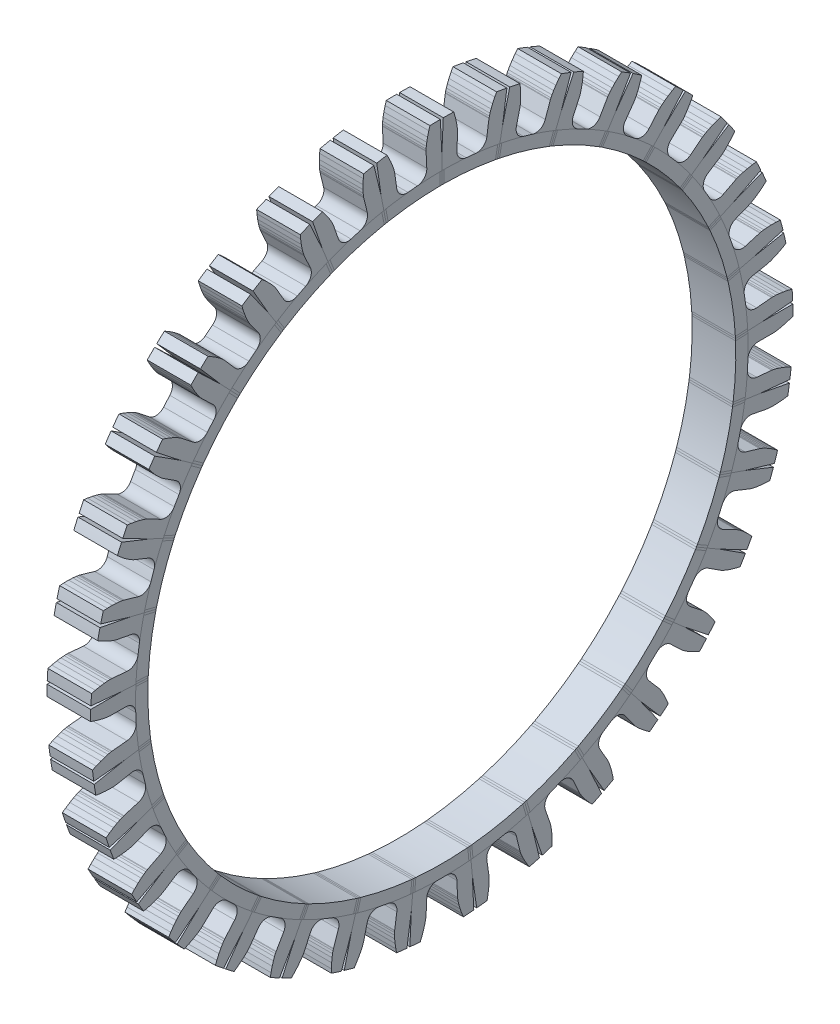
SolidWorks part; units mm, degrees
ref_plane "Plan1" through (0, 0, 0) normal (0, 0, 1) x (1, 0, 0)
ref_plane "Plan2" through (0, 0, 0) normal (0, 1, 0) x (1, 0, 0)
ref_plane "Plan3" through (0, 0, 0) normal (1, 0, 0) x (0, 0, -1)
imported_body "Importée1"
sketch "Esquisse1" plane through (0, 0, 0) normal (-1, 0, 0) x (0, 0, 1)
  line L1 (-16, -13) -> (13, -13)
  line L2 (-16, -13) -> (-16, 13)
  line L3 (-16, 13) -> (13, 13)
  line L4 (13, -13) -> (13, 13)
extrude "Enlèv. mat.-Extru.1" cut sketch "Esquisse1" against normal blind 1
